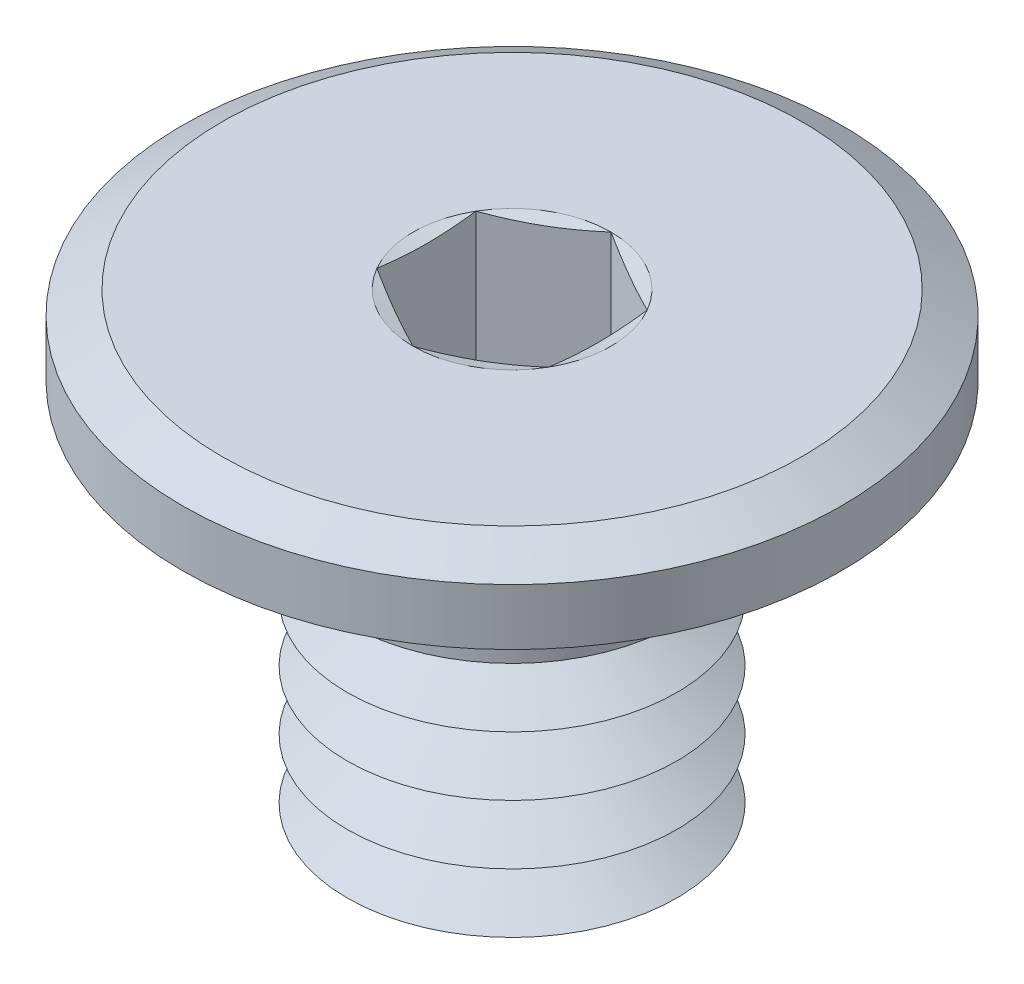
SolidWorks part; units mm, degrees
ref_plane "Front Plane" through (0, 0, 0) normal (0, 0, 1) x (1, 0, 0)
ref_plane "Top Plane" through (0, 0, 0) normal (0, 1, 0) x (1, 0, 0)
ref_plane "Right Plane" through (0, 0, 0) normal (1, 0, 0) x (0, 0, -1)
sketch "Sketch1" plane through (0, 0, 0) normal (0, 1, 0) x (1, 0, 0)
  circle A0 centre (0, 0) radius 2.5
  dimension "D1" = 5
extrude "Boss-Extrude1" add sketch "Sketch1" against normal blind 0.6
sketch "Sketch2" plane through (0, -0.6, 0) normal (0, -1, 0) x (1, 0, 0)
  circle A0 centre (0, 0) radius 1.25
  dimension "D1" = 2.5
extrude "Boss-Extrude2" add sketch "Sketch2" along normal blind 3
sketch "Sketch3" plane through (0, 0, 0) normal (1, 0, 0) x (0, 0, -1)
  line L0 (0, 0.9906) -> (0, -8.2999) construction
sketch "Sketch5" plane through (0, 0, 0) normal (1, 0, 0) x (0, 0, -1)
  line L0 (-1.25, -3.825) -> (-0.8603, -3.6)
  line L1 (-1.25, -0.6) -> (-1.25, -3.6) construction
  line L2 (-0.8603, -3.6) -> (-1.25, -3.375)
  line L3 (-1.25, -0.6) -> (-1.25, -3.6) construction
  line L4 (-1.25, -3.375) -> (-1.25, -3.825)
  line L6 (-1.25, -0.6) -> (-1.25, -3.6) construction
  line L7 (-1.25, -0.6) -> (-1.25, -3.6) construction
  line L14 (-1.25, -3.6) -> (1.25, -3.6) construction
  dimension "D1" = 0.45
revolve "Cut-Revolve1" cut sketch "Sketch5" angle 360 about L0
pattern_linear "LPattern1" count 5 spacing 0.45 along (0, 1, 0) of "Cut-Revolve1"
fillet "Fillet1" radius 0.1 1 edges at (0, -0.6, -1.25)
chamfer "Chamfer2" distance 0.3 angle 30 1 edges at (0, 0, 2.5)
sketch "Sketch6" plane through (0, 0, 0) normal (0, 1, 0) x (1, 0, 0)
  line L1 (0, 0.7506) -> (-0.65, 0.3753)
  line L2 (-0.65, 0.3753) -> (-0.65, -0.3753)
  line L3 (-0.65, -0.3753) -> (0, -0.7506)
  line L4 (0, -0.7506) -> (0.65, -0.3753)
  line L5 (0.65, -0.3753) -> (0.65, 0.3753)
  line L6 (0.65, 0.3753) -> (0, 0.7506)
  circle A0 centre (0, 0) radius 0.65 construction
  dimension "D1" = 1.3
extrude "Cut-Extrude1" cut sketch "Sketch6" against normal blind 1.2
sketch "Sketch7" plane through (0, -1.2, 0) normal (0, 1, 0) x (1, 0, 0)
  line L0 (-0.65, 0.3753) -> (-0.65, -0.3753) construction
  circle A0 centre (0, 0) radius 0.65
extrude "Cut-Extrude2" cut sketch "Sketch7" against normal through all draft 60
sketch "Sketch8" plane through (0, 0, 0) normal (0, 1, 0) x (1, 0, 0)
  circle A0 centre (0, 0) radius 0.7506
extrude "Cut-Extrude3" cut sketch "Sketch8" against normal through all draft 75
